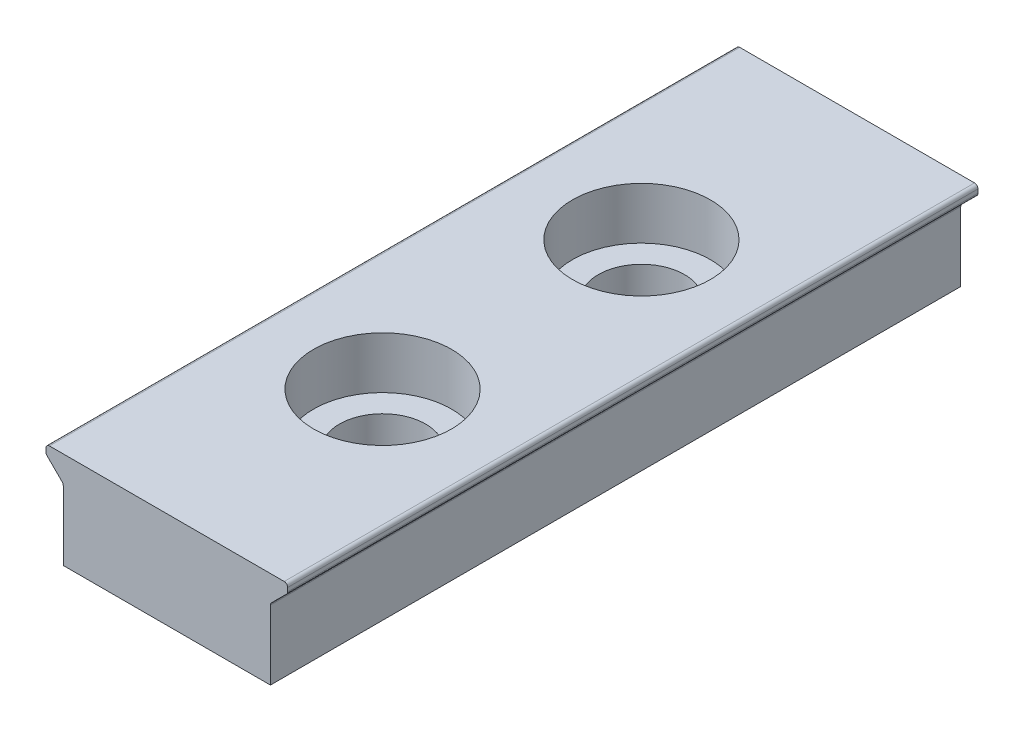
SolidWorks part; units mm, degrees
ref_plane "Front" through (0, 0, 0) normal (0, 0, 1) x (1, 0, 0)
ref_plane "bottom" through (0, 0, 0) normal (0, 1, 0) x (1, 0, 0)
ref_plane "center" through (0, 0, 0) normal (1, 0, 0) x (0, 0, -1)
sketch "Sketch2" plane through (0, 0, 0) normal (0, 0, 1) x (1, 0, 0)
  line L0 (0, 2.8) -> (3.501, 2.8)
  line L2 (0, 2.8) -> (0, 0)
  line L3 (0, 0) -> (3.001, 0)
  line L4 (3.001, 2.05) -> (3.001, 0)
  line L5 (3.501, 2.8) -> (3.501, 2.55)
  line L6 (3.501, 2.55) -> (3.001, 2.05)
  dimension "D1" = 3.001
  dimension "D2" = 2.8
  dimension "D3" = 45
  dimension "D4" = 0.25
  dimension "D5" = 0.5
extrude "Extrude3" add sketch "Sketch2" along normal blind 20
fillet "Fillet1" radius 0.1 3 edges at (3.001, 2.05, 10) (3.501, 2.55, 10) (3.501, 2.8, 10)
mirror "Mirror1" about plane through (0, 0, 0) normal (1, 0, 0) of "Extrude3", "Fillet1"
hole_wizard "CBORE for M3 SBHCS1" positions "Sketch4" profile "Sketch3" counterbore size "M3" standard "Ansi Metric"
sketch "Sketch4" plane through (0, 2.8, 0) normal (0, 1, 0) x (-1, 0, 0)
  line L0 (-3.401, 0) -> (3.401, 0) construction
  point P0 (0, 6.25)
  dimension "D1" = 6.25
sketch "Sketch3" plane through (0, 2.8, 6.25) normal (1, 0, 0) x (0, 0, 1)
  line L0 (0, 0) -> (0, 26.1511)
  line L1 (0, 26.1511) -> (1.25, 25.4)
  line L2 (1.25, 25.4) -> (1.25, 1.5)
  line L3 (1.25, 1.5) -> (2, 1.5)
  line L4 (2, 1.5) -> (2, 0)
  line L5 (2, 0) -> (0, 0)
  line L10 (0, 26.1511) -> (-1.25, 25.4) construction
  line L11 (0, -6.35) -> (0, 107.95) construction
  dimension "Hole Dia." = 2.5
  dimension "Hole Depth" = 25.4
  dimension "C'Bore Dia." = 4
  dimension "C'Bore Depth" = 1.5
  dimension "Drill Angle" = 118
pattern_linear "LPattern1" count 2 spacing 7.5 along (0, 0, 1) of "CBORE for M3 SBHCS1"
